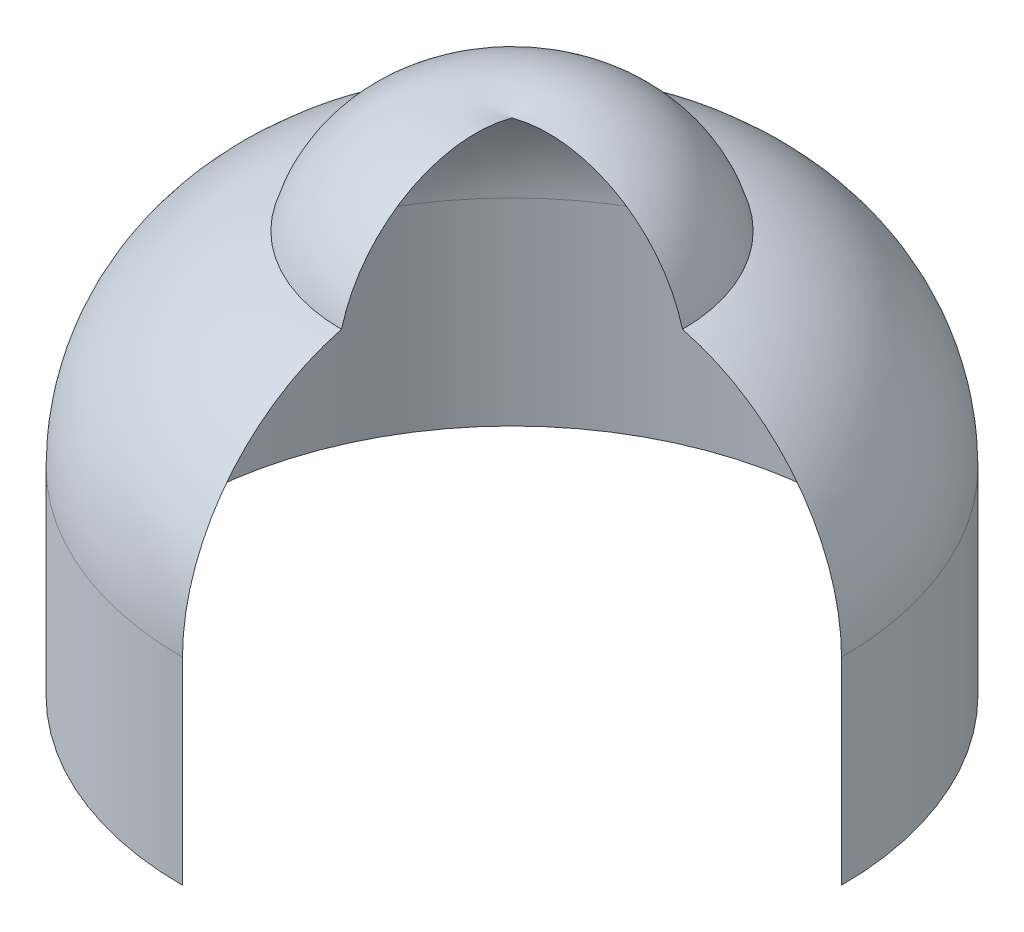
SolidWorks part; units mm, degrees
ref_plane "Front Plane" through (0, 0, 0) normal (0, 0, 1) x (1, 0, 0)
ref_plane "Top Plane" through (0, 0, 0) normal (0, 1, 0) x (1, 0, 0)
ref_plane "Right Plane" through (0, 0, 0) normal (1, 0, 0) x (0, 0, -1)
sketch "Sketch1" plane through (0, 0, 0) normal (0, 0, 1) x (1, 0, 0)
  line L0 (0, 79.0394) -> (0, -65.931) construction
  line L1 (67.2346, 4.2829) -> (67.2346, -36.013)
  arc A0 (0, 65.9701) -> (34.7982, 46.0098) centre (7.419, 38.5908) cw
  arc A1 (34.7982, 46.0098) -> (67.2346, 4.2829) centre (24.1771, 4.2829) cw
surface "Surface-Revolve1" sketch "Sketch1" parameters "D1"=270
